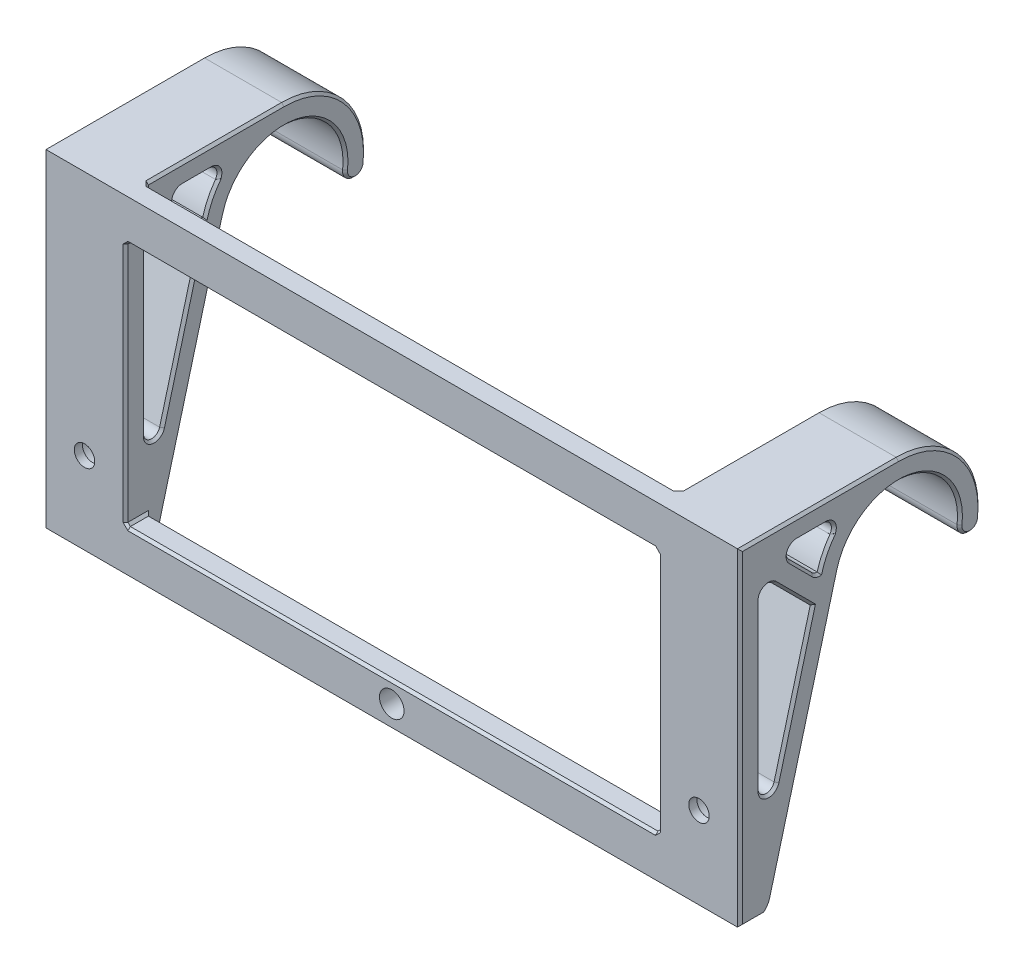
SolidWorks part; units mm, degrees
ref_plane "Front Plane" through (0, 0, 0) normal (0, 0, 1) x (1, 0, 0)
ref_plane "Top Plane" through (0, 0, 0) normal (0, 1, 0) x (1, 0, 0)
ref_plane "Right Plane" through (0, 0, 0) normal (1, 0, 0) x (0, 0, -1)
sketch "Sketch1" plane through (0, 0, 0) normal (1, 0, 0) x (0, 0, -1)
  line L0 (10.0759, 9.8142) -> (-6.3162, -51.3622)
  line L1 (-14.1458, -46.068) -> (-14.1458, 25.9319)
  line L2 (-14.1458, 25.9319) -> (24.5648, 25.9319)
  line L3 (-5.214, -27.8268) -> (3.6175, 5.1329)
  line L4 (3.6175, 5.1329) -> (-5.7316, 14.4821)
  line L5 (-9.1458, 13.0679) -> (-9.1458, -27.3092)
  line L6 (-0.2819, 20.9319) -> (6.7835, 20.9319)
  line L7 (-1.6961, 17.5177) -> (3.9428, 11.8788)
  line L8 (8.3951, 17.7476) -> (8.4138, 17.7279)
  line L9 (-14.1458, -46.068) -> (-14.1458, -54.0681)
  arc A0 (44.4338, 3.6462) -> (24.5648, 25.9319) centre (24.5648, 5.9319) ccw
  arc A1 (39.4665, 4.2176) -> (10.0759, 9.8142) centre (24.5648, 5.9319) ccw
  arc A2 (39.4665, 4.2176) -> (44.4338, 3.6462) centre (41.9502, 3.9319) ccw
  arc A3 (-14.1458, -54.0681) -> (-6.3162, -51.3622) centre (-11.1459, -50.0681) ccw
  arc A4 (3.9428, 11.8788) -> (5.297, 11.2939) centre (5.357, 13.293) ccw
  arc A5 (-0.2819, 20.9319) -> (-1.6961, 17.5177) centre (-0.2819, 18.9319) ccw
  arc A6 (8.3951, 17.7476) -> (6.7835, 20.9319) centre (6.7835, 18.9319) ccw
  arc A7 (-5.7316, 14.4821) -> (-9.1458, 13.0679) centre (-7.1458, 13.0679) ccw
  arc A8 (-9.1458, -27.3092) -> (-5.214, -27.8268) centre (-7.1458, -27.3092) ccw
  arc A9 (8.4138, 17.7279) -> (5.297, 11.2939) centre (24.5648, 5.9319) ccw
extrude "Boss-Extrude1" add sketch "Sketch1" along normal blind 170 contours L9 A3 L0 A1 A2 A0 L2 L1 A8 L5 A7 L4 L3 L8 A9 A4 L7 A5 L6 A6
sketch "Sketch5" plane through (0, 0, 14.1458) normal (0, 0, 1) x (1, 0, 0)
  line L0 (170, -54.0681) -> (0, -54.0681) construction
  line L1 (170, 25.9319) -> (150, 25.9319)
  line L2 (170, 25.9319) -> (170, -54.0681)
  line L3 (170, -54.0681) -> (150, -54.0681)
  line L4 (150, 25.9319) -> (150, -54.0681)
  line L6 (0, 25.9319) -> (20, 25.9319)
  line L7 (0, 25.9319) -> (0, -54.0681)
  line L8 (0, -54.0681) -> (20, -54.0681)
  line L9 (20, 25.9319) -> (20, -54.0681)
  line L10 (-43.8072, 65.0572) -> (268.0833, 65.0572)
  line L11 (-43.8072, 65.0572) -> (-43.8072, -101.906)
  line L12 (-43.8072, -101.906) -> (268.0833, -101.906)
  line L13 (268.0833, 65.0572) -> (268.0833, -101.906)
extrude "Cut-Extrude1" cut sketch "Sketch5" against normal blind 170
sketch "Sketch6" plane through (20, 0, 0) normal (1, 0, 0) x (0, 0, -1)
  line L1 (-14.1458, 25.9319) -> (-4.1458, 25.9319)
  line L2 (-14.1458, 25.9319) -> (-14.1458, 20.9319)
  line L3 (-14.1458, 20.9319) -> (-4.1458, 20.9319)
  line L4 (-4.1458, 25.9319) -> (-4.1458, 20.9319)
extrude "Boss-Extrude2" add sketch "Sketch6" along normal blind 140
sketch "Sketch7" plane through (0, 0, 14.1458) normal (0, 0, 1) x (1, 0, 0)
  line L0 (160, -54.0681) -> (160, -34.0681)
  line L1 (170, -54.0681) -> (150, -54.0681) construction
  line L2 (10, -54.0681) -> (10, -34.0681)
  line L3 (0, -54.0681) -> (20, -54.0681) construction
  circle A0 centre (160, -34.0681) radius 4
  circle A1 centre (10, -34.0681) radius 4
extrude "Cut-Extrude2" cut sketch "Sketch7" against normal blind 140
sketch "Sketch8" plane through (0, 0, 14.1458) normal (0, 0, 1) x (1, 0, 0)
  circle A0 centre (160, -34.0681) radius 4
  circle A1 centre (160, -34.0681) radius 2
  circle A2 centre (10, -34.0681) radius 4
  circle A3 centre (10, -34.0681) radius 2
extrude "Boss-Extrude3" add sketch "Sketch8" against normal blind 2
sketch "Sketch9" plane through (0, 0, 12.1458) normal (0, 0, -1) x (-1, 0, 0)
  circle A0 centre (-10, -34.0681) radius 4.5
extrude "Cut-Extrude3" cut sketch "Sketch9" along normal blind 25
sketch "Sketch10" plane through (0, 0, 12.1458) normal (0, 0, -1) x (-1, 0, 0)
  circle A0 centre (-160, -34.0681) radius 4.5
extrude "Cut-Extrude4" cut sketch "Sketch10" along normal blind 21
sketch "Sketch11" plane through (170, 0, 0) normal (1, 0, 0) x (0, 0, -1)
  line L1 (-14.1458, -54.0681) -> (-9.1458, -54.0681)
  line L2 (-14.1458, -54.0681) -> (-14.1458, -44.0681)
  line L3 (-14.1458, -44.0681) -> (-9.1458, -44.0681)
  line L4 (-9.1458, -54.0681) -> (-9.1458, -44.0681)
extrude "Boss-Extrude4" add sketch "Sketch11" against normal blind 160
sketch "Sketch12" plane through (20, 0, 0) normal (1, 0, 0) x (0, 0, -1)
  line L1 (-21.1611, 11.3913) -> (3.7833, 11.3913)
  line L2 (-21.1611, 11.3913) -> (-21.1611, 53.137)
  line L3 (-21.1611, 53.137) -> (3.7833, 53.137)
  line L4 (3.7833, 11.3913) -> (3.7833, 53.137)
extrude "Cut-Extrude5" cut sketch "Sketch12" along normal blind 130
sketch "Sketch13" plane through (20, 0, 0) normal (1, 0, 0) x (0, 0, -1)
  line L1 (-14.1458, 25.9319) -> (-9.1458, 25.9319)
  line L2 (-14.1458, 25.9319) -> (-14.1458, 15.9319)
  line L3 (-14.1458, 15.9319) -> (-9.1458, 15.9319)
  line L4 (-9.1458, 25.9319) -> (-9.1458, 15.9319)
extrude "Boss-Extrude5" add sketch "Sketch13" along normal blind 140
sketch "Sketch14" plane through (0, 0, 14.1458) normal (0, 0, 1) x (1, 0, 0)
  circle A0 centre (85, -49.0681) radius 2
extrude "Cut-Extrude6" cut sketch "Sketch14" against normal blind 140
chamfer "Chamfer8" distance 0.6 angle 45 92 edges at (0, 20.6671, -27.3707) (0, 1.4483, -41.6645) (0, 19.2414, -39.4932) (0, 25.9319, -5.2095) (0, -14.0681, 14.1458) (0, -54.0681, 11.1459) (0, -7.1206, 9.1458) (0, 14.9157, 7.9112) (0, 9.8075, 1.057) (0, -11.3469, 0.7982) (0, -29.2921, 7.4069) (0, 14.6513, -6.5656) (0, 11.4569, -4.564) (0, 14.6982, -1.1234) (0, 19.6972, 2.1296) (0, 20.9319, -3.2508) (0, 19.8351, -8.5679) (0, 17.7377, -8.4045) (20, 25.9319, -7.7095) (20, 19.2414, -39.4932) (20, 1.4483, -41.6645) (20, 20.6671, -27.3707) (20, -54.0681, 8.6459) (20, -49.0681, 9.1458) (20, -44.0681, 11.6458) (20, -14.0681, 14.1458) (20, 15.9319, 11.6458) (20, 20.9319, 9.1458) (20, 19.6972, 2.1296) (20, 14.6982, -1.1234) (20, 11.4569, -4.564) (20, 14.6513, -6.5656) (20, 17.7377, -8.4045) (20, 19.8351, -8.5679) (20, 20.9319, -3.2508) (20, -7.1206, 9.1458) (20, -29.2921, 7.4069) (20, -11.3469, 0.7982) (20, 9.8075, 1.057) (20, 14.9157, 7.9112) (85, -44.0681, 14.1458) (85, -54.0681, 9.1458) (85, 25.9319, 9.1458) (85, 15.9319, 14.1458) (150, -44.0681, 11.6458) (150, -49.0681, 9.1458) (150, -54.0681, 8.6459) (150, 20.6671, -27.3707) (150, 1.4483, -41.6645) (150, 19.2414, -39.4932) (150, 25.9319, -7.7095) (150, 20.9319, 9.1458) (150, 15.9319, 11.6458) (150, -14.0681, 14.1458) (150, 20.9319, -3.2508) (150, 19.8351, -8.5679) (150, 17.7377, -8.4045) (150, 14.6513, -6.5656) (150, 11.4569, -4.564) (150, 14.6982, -1.1234) (150, 19.6972, 2.1296) (150, 9.8075, 1.057) (150, -11.3469, 0.7982) (150, -29.2921, 7.4069) (150, -7.1206, 9.1458) (150, 14.9157, 7.9112) (170, 19.8351, -8.5679) (170, 20.9319, -3.2508) (170, 19.6972, 2.1296) (170, 14.6982, -1.1234) (170, 11.4569, -4.564) (170, 14.6513, -6.5656) (170, 17.7377, -8.4045) (170, -11.3469, 0.7982) (170, 9.8075, 1.057) (170, 14.9157, 7.9112) (170, -7.1206, 9.1458) (170, -29.2921, 7.4069) (170, 25.9319, -5.2095) (170, 19.2414, -39.4932) (170, 1.4483, -41.6645) (170, 20.6671, -27.3707) (170, -54.0681, 11.1459) (170, -14.0681, 14.1458)
sketch "Sketch15" plane through (0, 0, 9.1458) normal (0, 0, -1) x (-1, 0, 0)
  circle A0 centre (-85, -49.0681) radius 3
extrude "Cut-Extrude7" cut sketch "Sketch15" against normal blind 10
sketch "Sketch16" plane through (0, 0, 12.1458) normal (0, 0, -1) x (-1, 0, 0)
  circle A0 centre (-10, -34.0681) radius 2.5
  circle A1 centre (-160, -34.0681) radius 2.5
extrude "Cut-Extrude8" cut sketch "Sketch16" against normal blind 10
